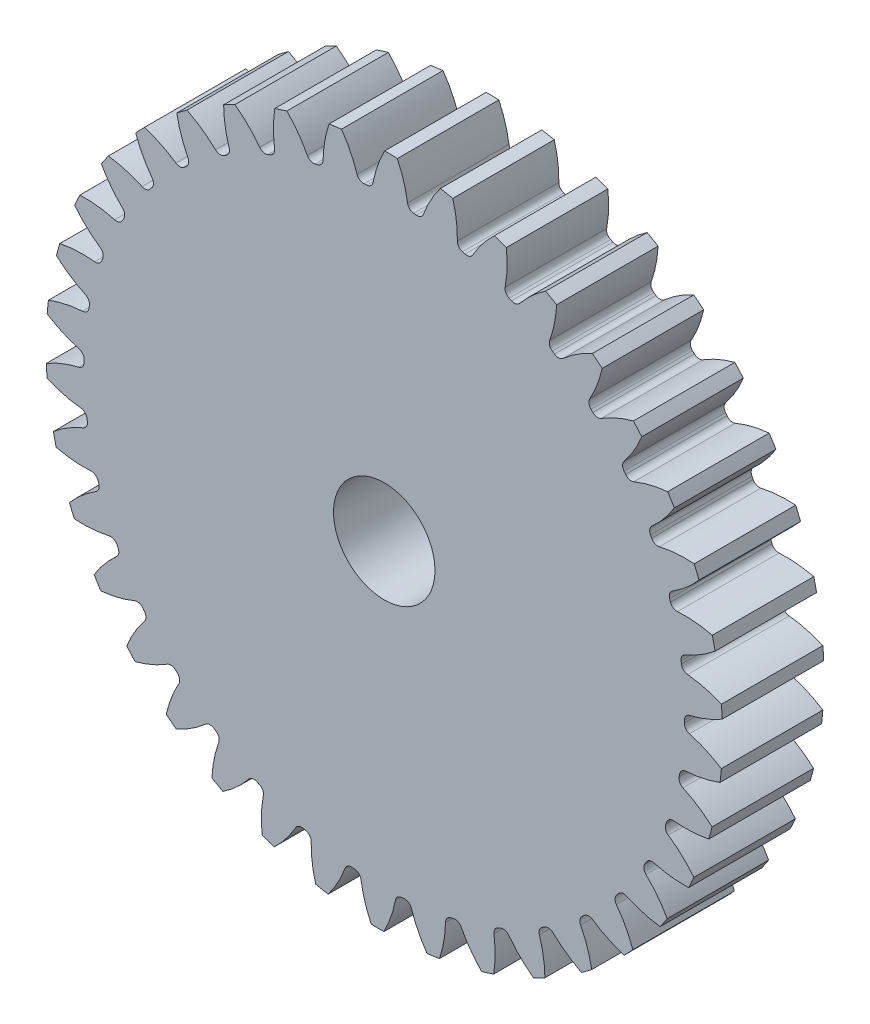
SolidWorks part; units mm, degrees
ref_plane "Front" through (0, 0, 0) normal (0, 0, 1) x (1, 0, 0)
ref_plane "Top" through (0, 0, 0) normal (0, 1, 0) x (1, 0, 0)
ref_plane "Right" through (0, 0, 0) normal (1, 0, 0) x (0, 0, -1)
sketch "Sketch3" plane through (0, 0, 0) normal (0, 0, 1) x (1, 0, 0)
  circle A0 centre (0, 0) radius 338.6667
  dimension "od" = 677.3333
extrude "gearBody" add sketch "Sketch3" along normal blind 101.6
sketch "Sketch2" plane through (0, 0, 0) normal (0, 0, 1) x (1, 0, 0)
  line L0 (0, 0) -> (279.3169, 115.6968) construction
  line L1 (337.7969, -28.5731) -> (0, 0) construction
  line L2 (0, 0) -> (36.3143, 0) construction
  line L3 (321.6605, 6.844) -> (321.133, -19.6456) construction
  line L5 (321.3968, -6.4008) -> (0, 0) construction
  line L7 (0, 0) -> (302.3304, 0) construction
  arc A0 (302.3281, 1.1874) -> (302.0411, -13.2238) centre (0, 0) ccw construction
  arc A1 (338.3384, 14.908) -> (337.4765, -28.3672) centre (0, 0) ccw construction
  arc A2 (321.6605, 6.844) -> (321.133, -19.6456) centre (0, 0) ccw construction
  arc A3 (300.4776, -7.3177) -> (300.5307, -4.6517) centre (0, 0) ccw
  arc A4 (337.7969, -28.5731) -> (305.5355, -14.1294) centre (274.4889, -126.7262) ccw
  arc A5 (337.7969, -28.5731) -> (338.6667, 15.101) centre (0, 0) ccw
  arc A6 (338.6667, 15.101) -> (305.8557, 1.9532) centre (279.3169, 115.6968) cw
  arc A7 (300.5307, -4.6517) -> (305.8557, 1.9532) centre (307.4217, -4.7584) cw
  arc A8 (305.5355, -14.1294) -> (300.4776, -7.3177) centre (307.3674, -7.4855) cw
  point P6 (338.6667, 15.101)
  point P22 (337.7969, -28.5731)
  dimension "baseDia" = 604.6609
  dimension "od" = 677.3333
  dimension "pd" = 643.4667
  dimension "rd" = 601.1333
  dimension "rFillet" = 6.8919
  dimension "pointX" = 338.6667
  dimension "pointY" = 15.101
  dimension "CTT" = 26.4896
  dimension "flankCenterAngle" = 22.5
extrude "toothCut" cut sketch "Sketch2" along normal through all
pattern_circular "CirPattern1" count 38 over 360 about axis through (0, 0, 0) along (0, 0, 1) of "toothCut"
sketch "hub1Dia" plane through (0, 0, 0) normal (0, 0, -1) x (-1, 0, 0)
  circle A0 centre (0, 0) radius 12.7
  dimension "hub1Dia" = 25.4
sketch "hub2Dia" plane through (0, 0, 101.6) normal (0, 0, 1) x (1, 0, 0)
  circle A0 centre (0, 0) radius 12.7
  dimension "hub2dia" = 25.4
sketch "boreDia" plane through (0, 0, 0) normal (0, 0, 1) x (1, 0, 0)
  circle A0 centre (0, 0) radius 50.8
  dimension "boreDia" = 101.6
extrude "bore" cut sketch "boreDia" against normal mid plane 25400
